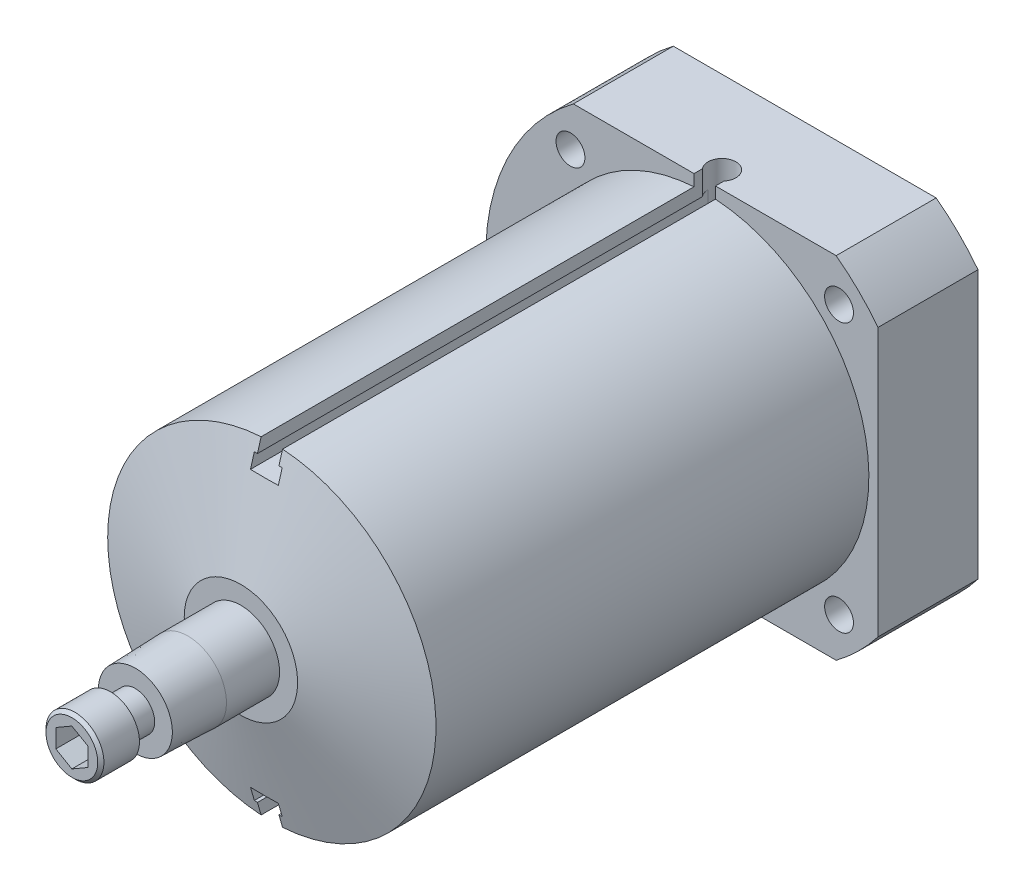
SolidWorks part; units mm, degrees
ref_plane "Front Plane" through (0, 0, 0) normal (0, 0, 1) x (1, 0, 0)
ref_plane "Top Plane" through (0, 0, 0) normal (0, 1, 0) x (1, 0, 0)
ref_plane "Right Plane" through (0, 0, 0) normal (1, 0, 0) x (0, 0, -1)
sketch "Sketch1" plane through (0, 0, 0) normal (0, 0, 1) x (1, 0, 0)
  line L0 (0, 0) -> (62.0084, 0) construction
  line L1 (-32.385, 43.18) -> (32.385, 43.18)
  line L2 (42.6974, 33.0187) -> (42.6974, -33.0187)
  line L3 (-32.385, -43.18) -> (32.385, -43.18)
  arc A0 (-32.385, 43.18) -> (-32.385, -43.18) centre (0, 0) ccw
  arc A1 (42.6974, 33.0187) -> (32.385, 43.18) centre (0, 0) ccw
  arc A2 (32.385, -43.18) -> (42.6974, -33.0187) centre (0, 0) ccw
  dimension "D1" = 107.95
  dimension "D2" = 86.36
  dimension "D3" = 42.6974
extrude "Extrude1" add sketch "Sketch1" along normal blind 138.938
sketch "Sketch2" plane through (0, 0, 0) normal (0, 1, 0) x (1, 0, 0)
  line L0 (0, 0) -> (0, -96.9332) construction
  line L1 (-53.975, -24.638) -> (-40.4495, -24.638)
  line L2 (-53.975, 0) -> (-53.975, -138.938) construction
  line L3 (-40.4495, -24.638) -> (-40.4495, -131.318)
  line L4 (-40.4495, -131.318) -> (-13.97, -138.938)
  line L7 (-13.97, -138.938) -> (-53.975, -138.938)
  line L8 (-53.975, -138.938) -> (-53.975, -24.638)
  dimension "D1" = 114.3
  dimension "D2" = 80.899
  dimension "D3" = 27.94
  dimension "D4" = 7.62
revolve "Cut-Revolve1" cut sketch "Sketch2" angle 360 about L0
sketch "Sketch4" plane through (0, 0, 0) normal (0, 1, 0) x (1, 0, 0)
  line L0 (0, 0) -> (0, -99.9671) construction
  line L1 (-9.5186, -138.938) -> (-9.5186, -152.019)
  line L2 (-13.97, -138.938) -> (13.97, -138.938) construction
  line L3 (-9.5186, -152.019) -> (-9.1122, -164.9509)
  line L4 (-9.1122, -164.9509) -> (0, -164.9509)
  line L7 (0, -164.9509) -> (0, -138.938)
  line L8 (0, -138.938) -> (-9.5186, -138.938)
  line L10 (-32.385, 0) -> (-53.975, 0) construction
  dimension "D1" = 1.8
  dimension "D4" = 19.0373
  dimension "D5" = 18.2245
  dimension "D6" = 12.9319
  dimension "D7" = 152.019
revolve "Revolve1" add sketch "Sketch4" angle 360 about L0
hole_wizard "Hole1" positions "Sketch6" profile "Sketch5" legacy
sketch "Sketch6" plane through (0, 0, 164.9509) normal (0, 0, 1) x (1, 0, 0)
  circle A0 centre (0, 0) radius 9.1122 construction
  point P0 (0, 0)
sketch "Sketch5" plane through (0, 0, 164.9509) normal (1, 0, 0) x (0, -1, 0)
  line L0 (0, 0) -> (0, 21.5835)
  line L1 (0, 21.5835) -> (4.2164, 19.05)
  line L2 (4.2164, 19.05) -> (4.2164, 0)
  line L4 (4.2164, 0) -> (0, 0)
  line L6 (0, 21.5835) -> (-4.2164, 19.05) construction
  line L7 (0, -4.2442) -> (0, 117.3081) construction
  dimension "Diameter" = 8.4328
  dimension "Depth" = 19.05
  dimension "Drill Angle" = 118
hole_wizard "Hole2" positions "Sketch10" profile "Sketch9" legacy
sketch "Sketch10" plane through (0, 0, 24.638) normal (0, 0, 1) x (1, 0, 0)
  line L1 (0, 0) -> (19.5659, 0) construction
  line L2 (0, 0) -> (33.0922, 33.0922) construction
  circle A0 centre (0, 0) radius 46.7995 construction
  point P0 (33.0922, 33.0922)
  dimension "D2" = 93.599
  dimension "D1" = 45
sketch "Sketch9" plane through (33.0922, 33.0922, 24.638) normal (1, 0, 0) x (0, -1, 0)
  line L0 (0, 0) -> (0, 24.639)
  line L1 (0, 24.639) -> (3.556, 24.639)
  line L2 (3.556, 24.639) -> (3.556, 0)
  line L3 (3.556, 0) -> (0, 0)
  line L4 (0, 110) -> (0, -10) construction
  dimension "Diameter" = 7.112
  dimension "Depth" = 24.639
pattern_circular "CirPattern1" count 4 over 360 about axis through (0, 0, 0) along (0, 0, 1) of "Hole2"
ref_plane "Plane1" through (0, 0, 15.7988) normal (0, 0, -1) x (-1, 0, 0)
sketch "Sketch11" plane through (0, 0, 15.7988) normal (0, 0, -1) x (-1, 0, 0)
  line L0 (0, 0) -> (24.6663, 11.5021) construction
  line L1 (0, 0) -> (27.0444, 0) construction
  line L2 (82.8388, 43.2246) -> (36.7984, 21.7556)
  line L3 (36.7984, 21.7556) -> (38.5589, 17.9803)
  line L4 (38.5589, 17.9803) -> (84.5993, 39.4493)
  line L5 (84.5993, 39.4493) -> (82.8388, 43.2246)
  dimension "D1" = 25
  dimension "D2" = 42.545
  dimension "D3" = 8.3312
  dimension "D4" = 50.8
revolve "Cut-Revolve2" cut sketch "Sketch11" angle 360 about L0
mirror "Mirror1" about plane through (0, 0, 0) normal (0, 1, 0) of "Cut-Revolve2"
sketch "Sketch12" plane through (0, 0, 138.938) normal (0, 0, 1) x (1, 0, 0)
  line L0 (0, 0) -> (0, 26.7352) construction
  line L1 (-2.6416, 50.8) -> (-2.6416, 37.2237)
  line L2 (-2.6416, 37.2237) -> (-3.429, 37.2237)
  line L3 (-3.429, 37.2237) -> (-3.429, 33.9217)
  line L4 (-3.429, 33.9217) -> (3.429, 33.9217)
  line L5 (3.429, 37.2237) -> (3.429, 33.9217)
  line L6 (2.6416, 37.2237) -> (3.429, 37.2237)
  line L7 (2.6416, 50.8) -> (2.6416, 37.2237)
  line L8 (-2.6416, 50.8) -> (2.6416, 50.8)
  dimension "D1" = 5.2832
  dimension "D2" = 6.858
  dimension "D3" = 3.302
  dimension "D4" = 33.9217
  dimension "D5" = 50.8
extrude "Cut-Extrude1" cut sketch "Sketch12" against normal blind 118.5418
sketch "Sketch13" plane through (0, 0, 138.938) normal (0, 0, 1) x (1, 0, 0)
  line L0 (0, 0) -> (32.0428, 0) construction
  line L1 (0, 0) -> (0, -27.5102) construction
  line L2 (-3.429, -33.9217) -> (3.429, -33.9217)
  line L3 (3.429, -33.9217) -> (3.429, -37.2237)
  line L4 (3.429, -37.2237) -> (2.6416, -37.2237)
  line L5 (2.6416, -37.2237) -> (2.6416, -50.8)
  line L6 (2.6416, -50.8) -> (-2.6416, -50.8)
  line L7 (-3.429, 33.9217) -> (3.429, 33.9217) construction
  line L8 (3.429, 37.2237) -> (3.429, 33.9217) construction
  line L9 (2.6416, 50.8) -> (2.6416, 37.2237) construction
  line L10 (-2.6416, -37.2237) -> (-2.6416, -50.8)
  line L11 (-3.429, -37.2237) -> (-2.6416, -37.2237)
  line L12 (-3.429, -33.9217) -> (-3.429, -37.2237)
extrude "Cut-Extrude2" cut sketch "Sketch13" against normal blind 98.425
sketch "Sketch14" plane through (0, 43.18, 0) normal (0, 1, 0) x (1, 0, 0)
  line L0 (-2.6416, -20.3962) -> (2.6416, -20.3962) construction
  circle A0 centre (0, -20.3962) radius 3.429
  dimension "D1" = 3.429
extrude "Cut-Extrude3" cut sketch "Sketch14" against normal up to surface (9.2583 mm away)
sketch "Sketch15" plane through (0, -43.18, 0) normal (0, -1, 0) x (1, 0, 0)
  line L0 (3.429, 40.513) -> (-3.429, 40.513) construction
  circle A0 centre (0, 40.513) radius 3.429
  dimension "D1" = 3.429
extrude "Cut-Extrude4" cut sketch "Sketch15" against normal up to surface (9.2583 mm away)
sketch "Sketch16" plane through (0, 0, 0) normal (0, 1, 0) x (1, 0, 0)
  line L0 (0, 0) -> (0, -122.9241) construction
  line L1 (-4.7625, -164.9509) -> (-4.7625, -171.069)
  line L2 (-9.1122, -164.9509) -> (9.1122, -164.9509) construction
  line L3 (-4.7625, -171.069) -> (-7.1374, -171.069)
  line L4 (-7.1374, -171.069) -> (-7.1374, -179.832)
  line L5 (-7.1374, -179.832) -> (-6.3754, -180.594)
  line L6 (-6.3754, -180.594) -> (0, -180.594)
  line L7 (0, -180.594) -> (0, -164.9509)
  line L8 (0, -164.9509) -> (-4.7625, -164.9509)
  line L9 (-9.5186, -152.019) -> (9.5186, -152.019) construction
  dimension "D1" = 9.525
  dimension "D2" = 19.05
  dimension "D3" = 14.2748
  dimension "D4" = 9.525
  dimension "D5" = 45
  dimension "D6" = 12.7508
revolve "Revolve2" add sketch "Sketch16" angle 360 about L0
sketch "Sketch17" plane through (0, 0, 180.594) normal (0, 0, 1) x (1, 0, 0)
  line L1 (3.9624, -2.2877) -> (3.9624, 2.2877)
  line L2 (3.9624, 2.2877) -> (0, 4.5754)
  line L3 (0, 4.5754) -> (-3.9624, 2.2877)
  line L4 (-3.9624, 2.2877) -> (-3.9624, -2.2877)
  line L5 (-3.9624, -2.2877) -> (0, -4.5754)
  line L6 (0, -4.5754) -> (3.9624, -2.2877)
  circle A0 centre (0, 0) radius 3.9624 construction
  dimension "D1" = 7.9248
extrude "Cut-Extrude5" cut sketch "Sketch17" against normal blind 6.35
